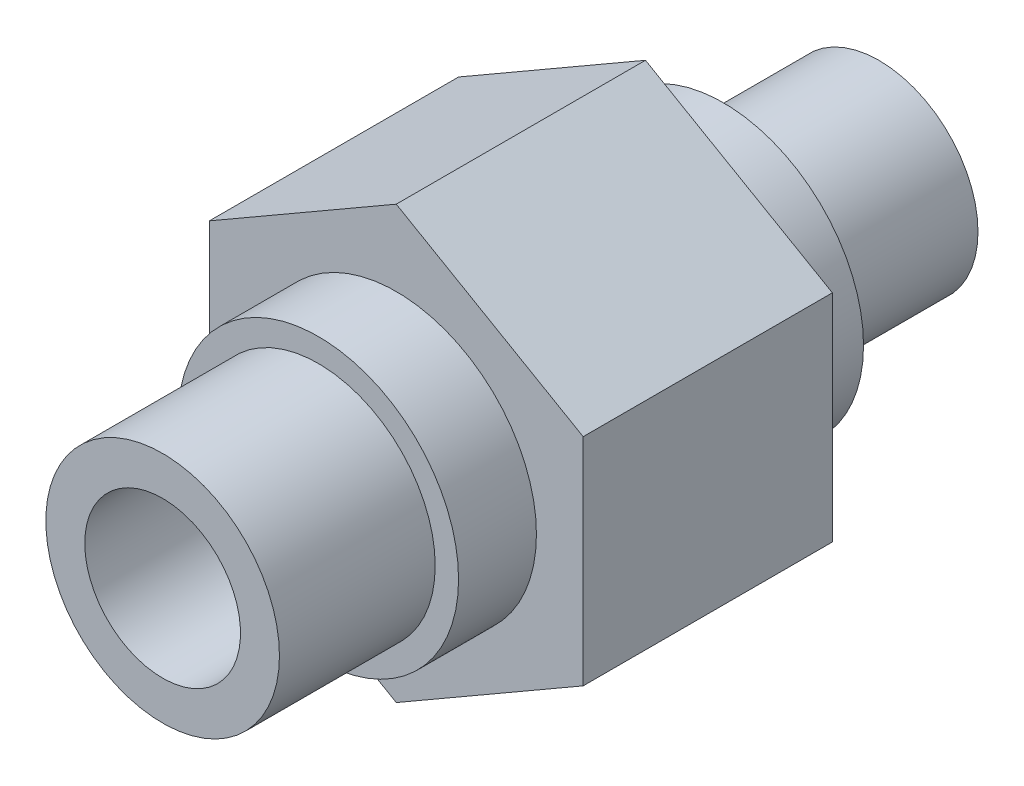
SolidWorks part; units mm, degrees
ref_plane "Płaszczyzna przednia" through (0, 0, 0) normal (0, 0, 1) x (1, 0, 0)
ref_plane "Płaszczyzna górna" through (0, 0, 0) normal (0, 1, 0) x (1, 0, 0)
ref_plane "Płaszczyzna prawa" through (0, 0, 0) normal (1, 0, 0) x (0, 0, -1)
sketch "Szkic1" plane through (0, 0, 0) normal (0, 0, 1) x (1, 0, 0)
  line L1 (0, 13.8564) -> (-12, 6.9282)
  line L2 (-12, 6.9282) -> (-12, -6.9282)
  line L3 (-12, -6.9282) -> (0, -13.8564)
  line L4 (0, -13.8564) -> (12, -6.9282)
  line L5 (12, -6.9282) -> (12, 6.9282)
  line L6 (12, 6.9282) -> (0, 13.8564)
  circle A0 centre (0, 0) radius 12 construction
  dimension "D1" = 24
extrude "Dodanie-wyciągnięcie1" add sketch "Szkic1" along normal mid plane 16
sketch "Szkic2" plane through (0, 0, 8) normal (0, 0, 1) x (1, 0, 0)
  circle A0 centre (0, 0) radius 9
  dimension "D1" = 18
extrude "Dodanie-wyciągnięcie2" add sketch "Szkic2" along normal blind 5
sketch "Szkic3" plane through (0, 0, 13) normal (0, 0, 1) x (1, 0, 0)
  circle A0 centre (0, 0) radius 7.5
  dimension "D1" = 15
extrude "Dodanie-wyciągnięcie3" add sketch "Szkic3" along normal blind 10
sketch "Szkic4" plane through (0, 0, -8) normal (0, 0, -1) x (-1, 0, 0)
  circle A0 centre (0, 0) radius 9
  dimension "D1" = 18
extrude "Dodanie-wyciągnięcie4" add sketch "Szkic4" along normal blind 5
sketch "Szkic5" plane through (0, 0, -13) normal (0, 0, -1) x (-1, 0, 0)
  circle A0 centre (0, 0) radius 6.35
  dimension "D1" = 12.7
extrude "Dodanie-wyciągnięcie5" add sketch "Szkic5" along normal blind 10
sketch "Szkic6" plane through (0, 0, -23) normal (0, 0, -1) x (-1, 0, 0)
  circle A0 centre (0, 0) radius 5
  dimension "D1" = 10
extrude "Wytnij-wyciągnięcie1" cut sketch "Szkic6" against normal through all
